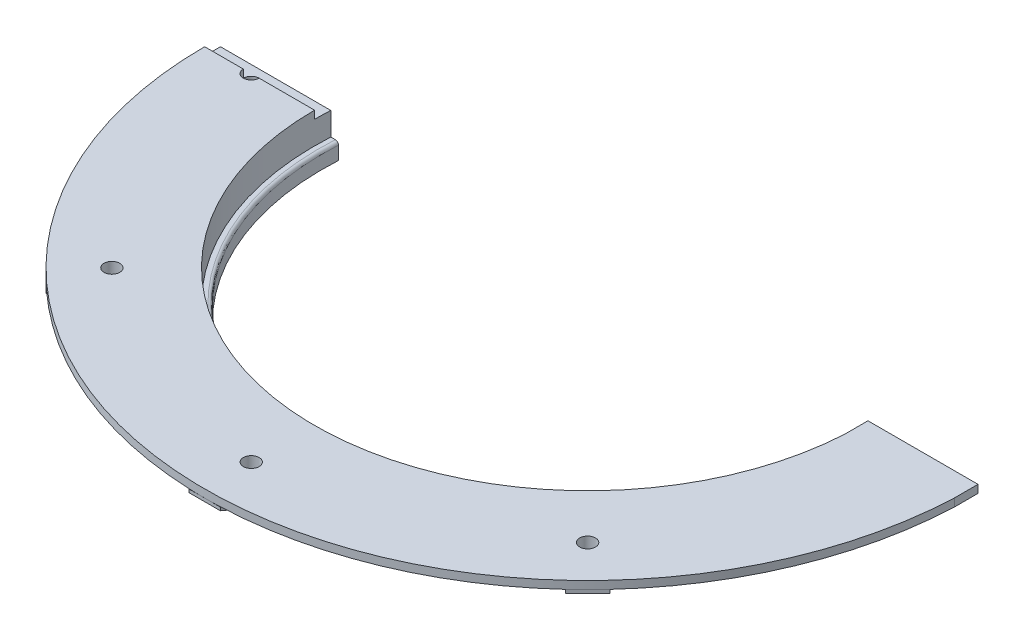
SolidWorks part; units mm, degrees
ref_plane "Front Plane" through (0, 0, 0) normal (0, 0, 1) x (1, 0, 0)
ref_plane "Top Plane" through (0, 0, 0) normal (0, 1, 0) x (1, 0, 0)
ref_plane "Right Plane" through (0, 0, 0) normal (1, 0, 0) x (0, 0, -1)
sketch "Sketch1" plane through (0, 0, 0) normal (0, 0, 1) x (1, 0, 0)
  line L0 (0, 0) -> (0, 51.4902) construction
  line L1 (-118.9355, 6.096) -> (-106.6927, 6.096)
  line L2 (-118.9355, 6.096) -> (-118.9355, 21.971)
  line L3 (-118.9355, 25.146) -> (-109.7915, 25.146)
  line L4 (-109.7915, 25.146) -> (-109.7915, 12.7)
  line L5 (-109.7915, 12.7) -> (-107.9627, 12.7)
  line L6 (-106.6927, 11.43) -> (-106.6927, 6.096)
  line L7 (-118.9355, 21.971) -> (-153.9875, 21.971)
  line L8 (-153.9875, 21.971) -> (-153.9875, 25.146)
  line L9 (-118.9355, 25.146) -> (-153.9875, 25.146)
  line L12 (-109.5375, 12.7) -> (109.5375, 12.7) construction
  line L14 (-106.4387, 11.43) -> (-106.4387, -798.83) construction
  line L15 (-109.5375, 25.4) -> (-109.5375, 12.7) construction
  arc A0 (-107.9627, 12.7) -> (-106.6927, 11.43) centre (-107.9627, 11.43) cw
  dimension "D4" = 1.27
  dimension "D1" = 9.144
  dimension "D2" = 0.254
  dimension "D3" = 19.05
  dimension "D5" = 0.254
  dimension "D6" = 0.254
  dimension "D7" = 3.175
  dimension "D8" = 307.975
revolve "Revolve1" add sketch "Sketch1" angle 360 about L0
sketch "Sketch19" plane through (0, 0, 0) normal (0, 0, 1) x (1, 0, 0)
  line L0 (-153.9875, 21.971) -> (-117.6655, 21.971)
  line L1 (-118.9355, 6.096) -> (-117.6655, 6.096)
  line L2 (-118.9355, 6.096) -> (-153.9875, 20.701)
  line L3 (-118.9355, 6.096) -> (-106.6927, 6.096) construction
  line L4 (-117.6655, 6.096) -> (-117.6655, 21.971)
  line L5 (-118.9355, 21.971) -> (118.9355, 21.971) construction
  line L6 (-118.9355, 6.096) -> (-118.9355, 21.971) construction
  line L7 (-153.9875, 21.971) -> (-153.9875, 20.701)
  dimension "D1" = 1.27
  dimension "D2" = 1.27
extrude "Boss-Extrude5" add sketch "Sketch19" along normal mid plane 12.7
hole_wizard "1/4-20 Tapped Hole1" positions "Sketch16" profile "Sketch15" tap size "1/4-20" standard "ANSI Inch"
sketch "Sketch16" plane through (0, 25.146, 0) normal (0, -1, 0) x (-1, 0, 0)
  point P0 (-135.255, 0)
sketch "Sketch15" plane through (135.255, 25.146, 0) normal (1, 0, 0) x (0, 0, 1)
  line L0 (0, 0) -> (0, 19.05)
  line L1 (0, 19.05) -> (3.175, 19.05)
  line L2 (3.175, 19.05) -> (3.175, 0)
  line L5 (3.175, 0) -> (0, 0)
  line L11 (0, -6.35) -> (0, 107.95) construction
  dimension "Thread Major Dia." = 6.35
  dimension "Thru Tap Drill Depth" = 19.05
pattern_circular "CirPattern1" count 8 over 360 about axis through (0, 0, 0) along (0, 1, 0) of "1/4-20 Tapped Hole1", "Boss-Extrude5"
sketch "Sketch21" plane through (0, 6.096, 0) normal (0, -1, 0) x (1, 0, 0)
  line L0 (-153.8565, -6.35) -> (-68.5179, -6.35)
  line L1 (-68.5179, -6.35) -> (-68.5179, 6.35)
  line L2 (-68.5179, 6.35) -> (153.9875, 6.35)
  line L3 (-153.8565, -6.35) -> (-153.8565, -156.6056)
  line L4 (-153.8565, -156.6056) -> (153.9875, -156.6056)
  line L5 (153.9875, -156.6056) -> (153.9875, 6.35)
extrude "Cut-Extrude1" cut sketch "Sketch21" against normal through all
sketch "Sketch22" plane through (0, 25.146, 0) normal (0, 1, 0) x (1, 0, 0)
  line L1 (-153.9875, 0) -> (-106.5036, 0)
  line L2 (-153.9875, 0) -> (-153.9875, 6.35)
  line L3 (-153.9875, 6.35) -> (-106.5036, 6.35)
  line L4 (-106.5036, 0) -> (-106.5036, 6.35)
extrude "Cut-Extrude2" cut sketch "Sketch22" against normal up to surface (3.175 mm away)
sketch "Sketch23" plane through (0, 25.146, 0) normal (0, 1, 0) x (1, 0, 0)
  line L1 (153.8565, -6.35) -> (109.6077, -6.35)
  line L2 (153.8565, -6.35) -> (153.8565, 3.0952)
  line L3 (153.8565, 3.0952) -> (109.6077, 3.0952)
  line L4 (109.6077, -6.35) -> (109.6077, 3.0952)
extrude "Boss-Extrude6" add sketch "Sketch23" against normal up to surface (3.175 mm away)
